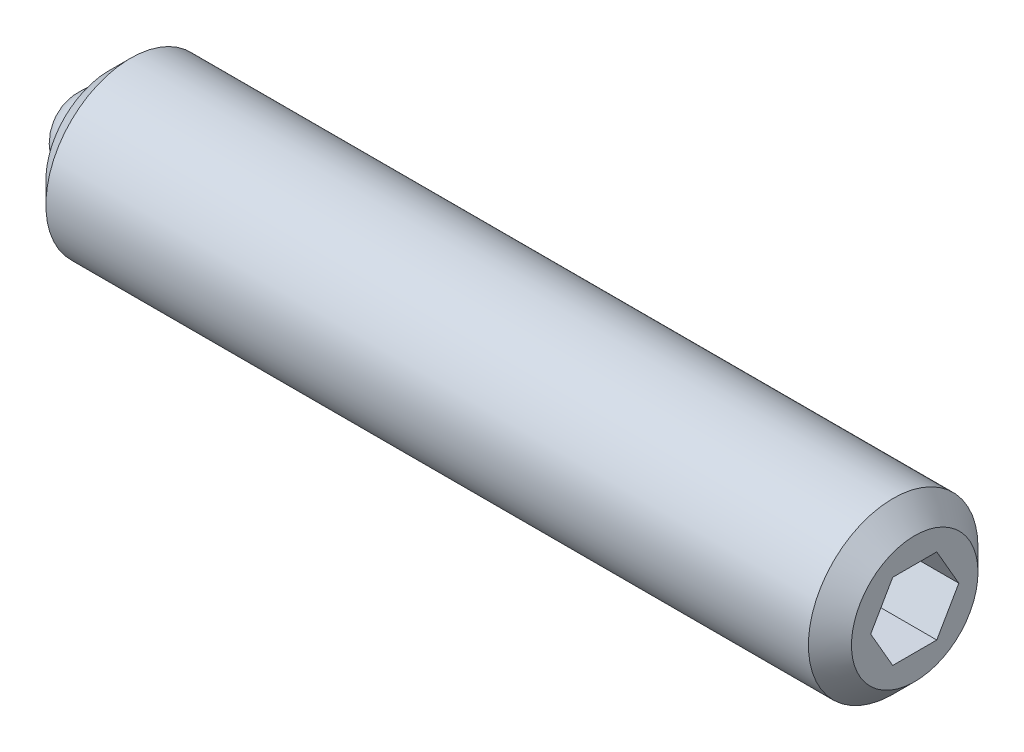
SolidWorks part; units mm, degrees
ref_plane "Front Plane" through (0, 0, 0) normal (0, 0, 1) x (1, 0, 0)
ref_plane "Top Plane" through (0, 0, 0) normal (0, 1, 0) x (1, 0, 0)
ref_plane "Right Plane" through (0, 0, 0) normal (1, 0, 0) x (0, 0, -1)
sketch "Sketch2" plane through (0, 0, 0) normal (1, 0, 0) x (0, 0, -1)
  circle A0 centre (0, 0) radius 1
  dimension "D1" = 2
extrude "Boss-Extrude1" add sketch "Sketch2" along normal blind 9.5
sketch "Sketch3" plane through (0, 0, 0) normal (-1, 0, 0) x (0, 0, 1)
  circle A0 centre (0, 0) radius 0.5
  dimension "D1" = 1
chamfer "Chamfer1" distance 0.254 angle 45 1 edges at (0, 0, -1)
chamfer "Chamfer2" distance 0.254 angle 45 1 edges at (9.5, 0, -1)
sketch "Sketch4" plane through (9.5, 0, 0) normal (1, 0, 0) x (0, 0, -1)
  line L1 (0.5196, 0) -> (0.2598, 0.45)
  line L2 (0.2598, 0.45) -> (-0.2598, 0.45)
  line L3 (-0.2598, 0.45) -> (-0.5196, 0)
  line L4 (-0.5196, 0) -> (-0.2598, -0.45)
  line L5 (-0.2598, -0.45) -> (0.2598, -0.45)
  line L6 (0.2598, -0.45) -> (0.5196, 0)
  circle A0 centre (0, 0) radius 0.45 construction
  dimension "D1" = 0.9
extrude "Cut-Extrude2" cut sketch "Sketch4" against normal blind 2
extrude "Cut-Extrude3" cut sketch "Sketch3" against normal blind 0.5
sketch "Sketch5" plane through (0, 0, 0) normal (-1, 0, 0) x (0, 0, 1)
  line L0 (0, 0) -> (0, -0.5)
  line L1 (0, 0) -> (0, 0.5)
  arc A0 (0, 0.5) -> (0, -0.5) centre (0, 0) ccw
  dimension "D1" = 0.5
revolve "Revolve1" add sketch "Sketch5" angle 360 about L1
